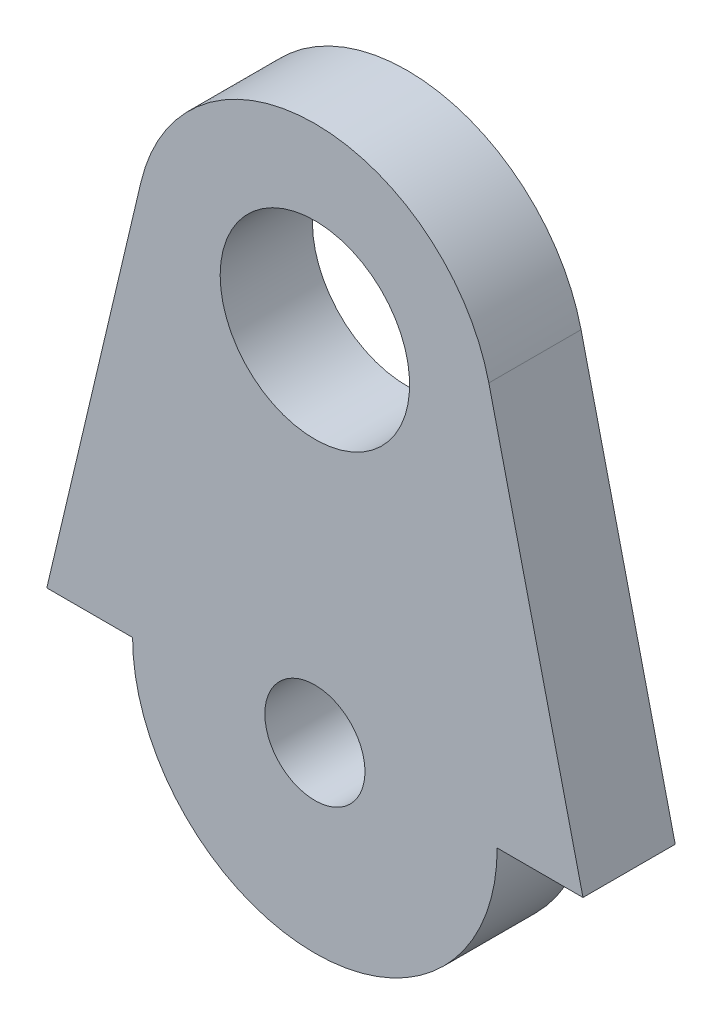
SolidWorks part; units mm, degrees
ref_plane "Front Plane" through (0, 0, 0) normal (0, 0, 1) x (1, 0, 0)
ref_plane "Top Plane" through (0, 0, 0) normal (0, 1, 0) x (1, 0, 0)
ref_plane "Right Plane" through (0, 0, 0) normal (1, 0, 0) x (0, 0, -1)
sketch "Sketch1" plane through (0, 0, 0) normal (0, 0, 1) x (1, 0, 0)
  line L0 (6.477, 0) -> (9.525, 0)
  line L1 (0, 0) -> (0, 92.6798) construction
  line L2 (9.525, 0) -> (6.1799, 14.1599)
  line L3 (-6.477, 0) -> (-9.525, 0)
  line L4 (-9.525, 0) -> (-6.1799, 14.1599)
  circle A0 centre (0, 0) radius 1.778
  arc A1 (-6.477, 0) -> (6.477, 0) centre (0, 0) ccw
  arc A2 (6.1799, 14.1599) -> (-6.1799, 14.1599) centre (0, 12.7) ccw
  circle A3 centre (0, 12.7) radius 3.3655
  dimension "D2" = 3.556
  dimension "D3" = 12.954
  dimension "D4" = 12.7
  dimension "D5" = 6.731
  dimension "D6" = 6.35
  dimension "D1" = 19.05
extrude "Boss-Extrude1" add sketch "Sketch1" along normal mid plane 3.2766
equation "\".1290.100in\"=0.1"
